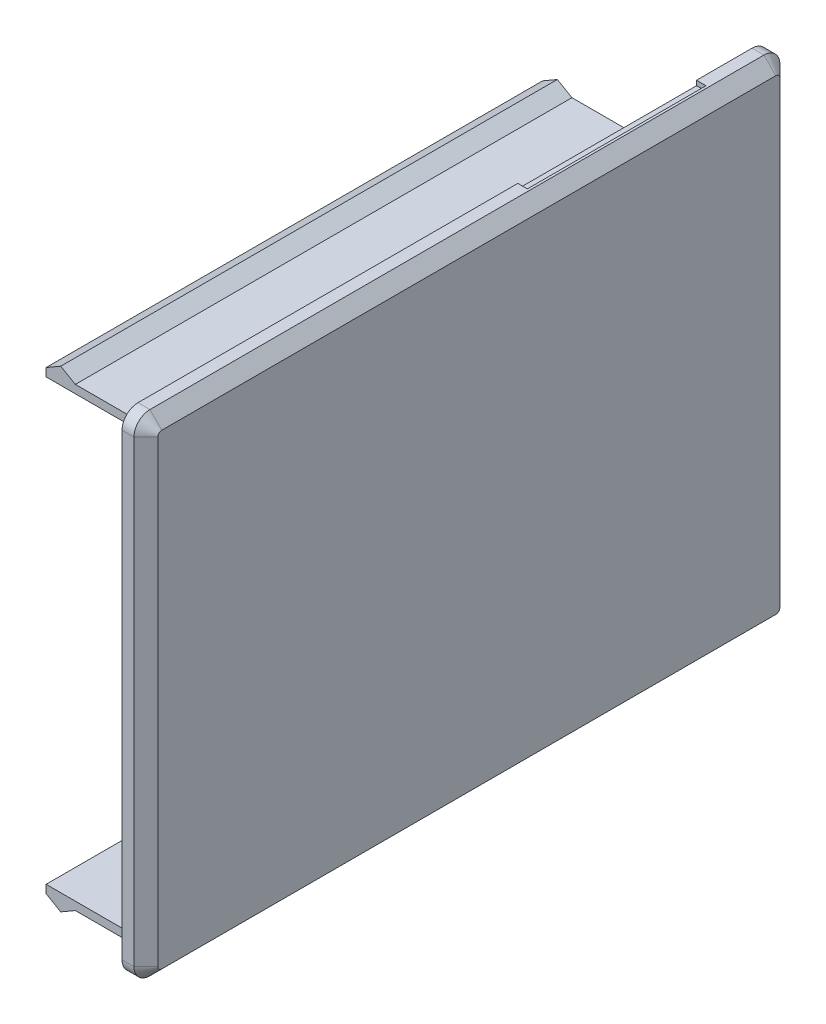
SolidWorks part; units mm, degrees
ref_plane "Front Plane" through (0, 0, 0) normal (0, 0, 1) x (1, 0, 0)
ref_plane "Top Plane" through (0, 0, 0) normal (0, 1, 0) x (1, 0, 0)
ref_plane "Right Plane" through (0, 0, 0) normal (1, 0, 0) x (0, 0, -1)
sketch "Sketch2" plane through (0, 0, 0) normal (1, 0, 0) x (0, 0, -1)
  line L1 (0, 0) -> (68.86, 0)
  line L2 (0, 0) -> (0, 52.28)
  line L3 (0, 52.28) -> (68.86, 52.28)
  line L4 (68.86, 0) -> (68.86, 52.28)
  line L5 (-67.31, 52.28) -> (97.4126, 52.28) construction
  line L6 (67.74, 47.405) -> (70.28, 47.405) construction
  point P6 (69.01, 47.405)
  dimension "D1" = 0.15
extrude "Boss-Extrude1" add sketch "Sketch2" along normal blind 2.54
sketch "Sketch3" plane through (0, 0, 0) normal (-1, 0, 0) x (0, 0, 1)
  line L0 (67.31, 50.58) -> (-97.4126, 50.58) construction
  line L1 (-1.9, 50.43) -> (-67.54, 50.43)
  line L2 (-1.9, 50.43) -> (-1.9, 1.85)
  line L3 (-1.9, 1.85) -> (-67.54, 1.85)
  line L4 (-67.54, 50.43) -> (-67.54, 1.85)
  line L5 (-97.4126, 1.7) -> (-1.27, 1.7) construction
  line L8 (-67.74, 1.7) -> (-67.74, 47.405) construction
  line L9 (-1.7, 1.7) -> (-1.7, 50.58) construction
  dimension "D1" = 0.15
  dimension "D2" = 0.15
  dimension "D3" = 0.2
  dimension "D4" = 0.2
extrude "Extrude-Thin1" add sketch "Sketch3" along normal blind 0.762 thin
sketch "Sketch4" plane through (0, 0, -1.9) normal (0, 0, 1) x (1, 0, 0)
  line L0 (-0.762, 50.43) -> (-6.8767, 50.43)
  line L1 (-6.8767, 50.43) -> (-8.4356, 51.33)
  line L2 (-8.4356, 51.33) -> (-9.9944, 50.43)
  line L3 (-9.9944, 50.43) -> (-9.9944, 49.56)
  line L4 (-9.9944, 49.56) -> (-0.762, 49.56)
  line L5 (-0.762, 1.85) -> (-0.762, 50.43) construction
  line L6 (-0.762, 49.56) -> (-0.762, 50.43)
  line L7 (-6.8767, 50.43) -> (-9.9944, 50.43) construction
  point P3 (-8.4356, 50.43)
  dimension "D1" = 6.1147
  dimension "D2" = 0.9
  dimension "D3" = 120
extrude "Boss-Extrude2" add sketch "Sketch4" against normal up to surface (65.64 mm away)
ref_plane "Plane1" through (0, 26.14, 0) normal (0, 1, 0) x (1, 0, 0)
fillet "Fillet1" radius 1.7 4 edges at (1.27, 52.28, 0) (1.27, 0, 0) (1.27, 52.28, -68.86) (1.27, 0, -68.86)
sketch "Sketch5" plane through (0, 0, -68.86) normal (0, 0, -1) x (-1, 0, 0)
  line L0 (0, 52.28) -> (-1.016, 52.28)
  line L1 (-2.54, 52.28) -> (0, 52.28) construction
  line L2 (-1.016, 52.28) -> (-1.016, 51.772)
  line L3 (0, 50.58) -> (0, 52.28) construction
  line L4 (0, 51.772) -> (0, 52.28)
  line L5 (-1.016, 51.772) -> (0, 51.772)
  dimension "D1" = 1.016
  dimension "D2" = 0.508
extrude "Cut-Extrude1" cut sketch "Sketch5" against normal blind 19.05 from offset 7.62
mirror "Mirror3" about plane through (0, 26.14, 0) normal (0, 1, 0) of "Cut-Extrude1", "Boss-Extrude2"
chamfer "Chamfer1" distance 1.27 angle 45 8 edges at (2.54, 0, -34.43) (2.54, 0.4979, -68.3621) (2.54, 0.4979, -0.4979) (2.54, 26.14, -68.86) (2.54, 26.14, 0) (2.54, 51.7821, -68.3621) (2.54, 51.7821, -0.4979) (2.54, 52.28, -34.43)
sketch "Sketch6" plane through (0, 52.28, 0) normal (0, 1, 0) x (1, 0, 0)
  line L0 (-9.9944, 67.54) -> (-9.9944, 1.9) construction
  line L1 (-0.762, 67.54) -> (-9.9944, 67.54)
  line L2 (-0.762, 67.54) -> (-0.762, 54.84)
  line L3 (-0.762, 54.84) -> (-9.9944, 54.84)
  line L4 (-9.9944, 67.54) -> (-9.9944, 54.84)
  line L5 (-0.762, 67.54) -> (-9.9944, 67.54) construction
  dimension "D1" = 12.7
extrude "Cut-Extrude2" cut sketch "Sketch6" against normal up to vertex (2.72 mm away)
